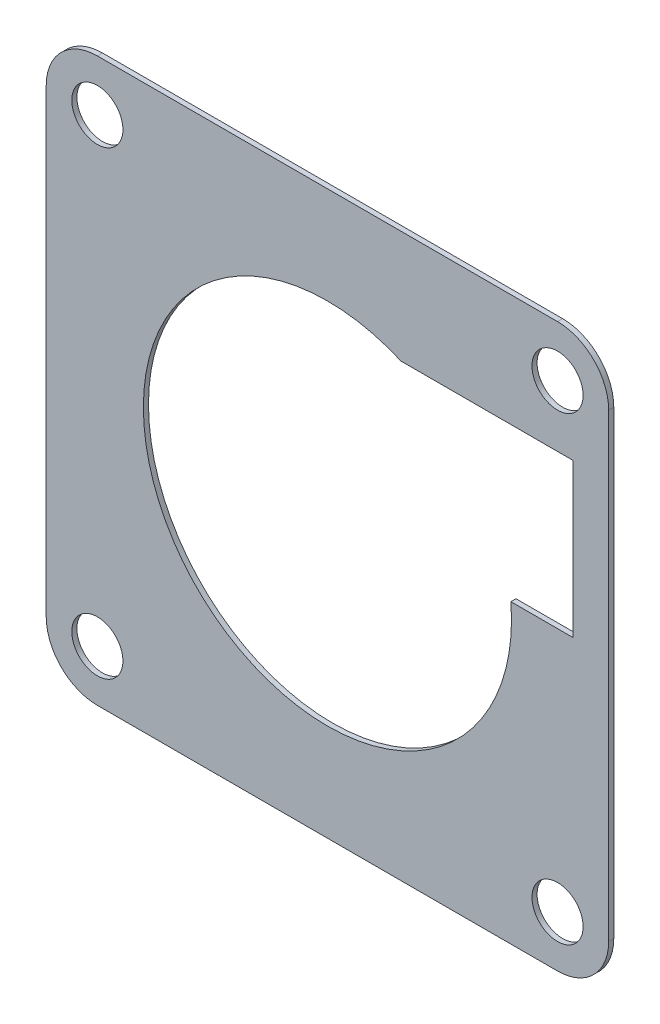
SolidWorks part; units mm, degrees
ref_plane "face" through (0, 0, 0) normal (0, 0, 1) x (1, 0, 0)
ref_plane "dessus" through (0, 0, 0) normal (0, 1, 0) x (1, 0, 0)
ref_plane "profil" through (0, 0, 0) normal (1, 0, 0) x (0, 0, -1)
sketch "Esquisse1" plane through (0, 0, 0) normal (0, 0, 1) x (1, 0, 0)
  line L1 (-27.5, 27.5) -> (27.5, 27.5)
  line L2 (-27.5, 27.5) -> (-27.5, -27.5)
  line L3 (-27.5, -27.5) -> (27.5, -27.5)
  line L4 (27.5, 27.5) -> (27.5, -27.5)
  dimension "D1" = 55
  dimension "D2" = 55
  dimension "D3" = 27.5
  dimension "D4" = 27.5
extrude "Base-Extrusion" add sketch "Esquisse1" along normal blind 0.5
fillet "Congé1" radius 5
sketch "Esquisse2" plane through (0, 0, 0.5) normal (0, 0, 1) x (1, 0, 0)
  line L0 (-33.3686, 0) -> (32.3016, 0) construction
  line L1 (0, 19.3034) -> (0, -30.3616) construction
  circle A0 centre (-22.5, 22.5) radius 2.5
  arc A1 (-22.5, 27.5) -> (-27.5, 22.5) centre (-22.5, 22.5) ccw construction
  circle A2 centre (22.5, 22.5) radius 2.5
  circle A3 centre (22.5, -22.5) radius 2.5
  circle A4 centre (-22.5, -22.5) radius 2.5
  dimension "D1" = 5
extrude "Enlèv. mat.-Extru.1" cut sketch "Esquisse2" against normal through all
sketch "Esquisse3" plane through (0, 0, 0.5) normal (0, 0, 1) x (1, 0, 0)
  line L0 (7.1937, 16.5) -> (24, 16.5)
  line L1 (24, 16.5) -> (24, 1.5)
  line L2 (24, 1.5) -> (17.9374, 1.5)
  arc A0 (7.1937, 16.5) -> (17.9374, 1.5) centre (0, 0) ccw
  dimension "D1" = 36
  dimension "D2" = 15
  dimension "D3" = 1.5
  dimension "D4" = 24
extrude "Enlèv. mat.-Extru.2" cut sketch "Esquisse3" against normal through all
